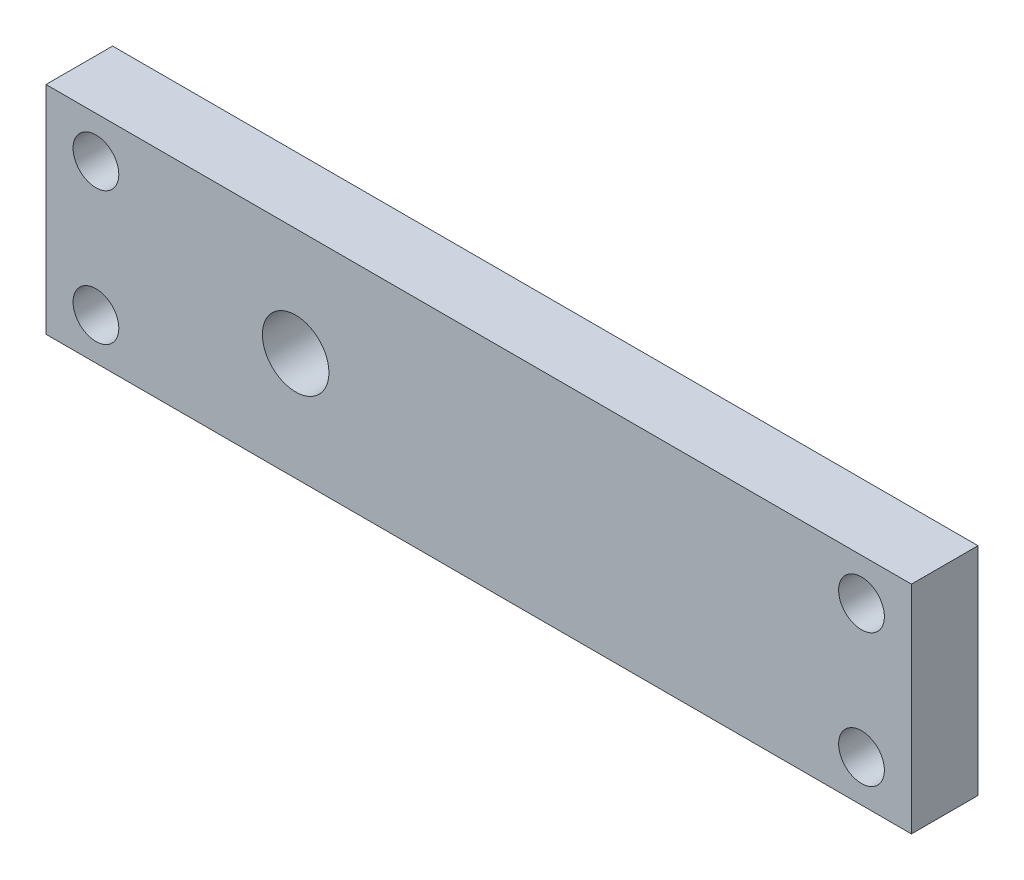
SolidWorks part; units mm, degrees
ref_plane "Face" through (0, 0, 0) normal (0, 0, 1) x (1, 0, 0)
ref_plane "Dessus" through (0, 0, 0) normal (0, 1, 0) x (1, 0, 0)
ref_plane "Droite" through (0, 0, 0) normal (1, 0, 0) x (0, 0, -1)
sketch "Esquisse1" plane through (0, 0, 0) normal (0, 0, 1) x (1, 0, 0)
  line L1 (0, 0) -> (104, 0)
  line L2 (0, 0) -> (0, 26)
  line L3 (0, 26) -> (104, 26)
  line L4 (104, 0) -> (104, 26)
  dimension "D1" = 104
  dimension "D2" = 26
extrude "Extrusion1" add sketch "Esquisse1" along normal blind 8
sketch "Esquisse2" plane through (0, 0, 8) normal (0, 0, 1) x (1, 0, 0)
  line L0 (104, 26) -> (0, 26) construction
  line L1 (0, 26) -> (0, 0) construction
  circle A0 centre (30, 13) radius 4
  dimension "D1" = 8
  dimension "D2" = 13
  dimension "D3" = 30
extrude "Enlèv. mat.-Extru.1" cut sketch "Esquisse2" against normal through all
hole_wizard "Dégagement M51" positions "Esquisse4" profile "Esquisse3" hole size "M5" standard "ISO"
sketch "Esquisse4" plane through (0, 0, 8) normal (0, 0, 1) x (1, 0, 0)
  line L0 (104, 26) -> (0, 26) construction
  line L1 (0, 0) -> (104, 0) construction
  line L2 (0, 26) -> (0, 0) construction
  line L3 (104, 0) -> (104, 26) construction
  point P0 (6, 21)
  point P1 (6, 5)
  point P3 (98, 21)
  point P5 (98, 5)
  dimension "D1" = 5
  dimension "D2" = 5
  dimension "D3" = 5
  dimension "D4" = 5
  dimension "D5" = 6
  dimension "D6" = 6
  dimension "D7" = 6
  dimension "D8" = 6
sketch "Esquisse3" plane through (6, 21, 8) normal (1, 0, 0) x (0, -1, 0)
  line L0 (0, 0) -> (0, 64.1524)
  line L1 (0, 64.1524) -> (2.75, 62.5)
  line L2 (2.75, 62.5) -> (2.75, 0)
  line L5 (2.75, 0) -> (0, 0)
  line L10 (0, 64.1524) -> (-2.75, 62.5) construction
  line L11 (0, -6.35) -> (0, 107.95) construction
  dimension "Diamètre du perçage" = 5.5
  dimension "Profondeur du perçage" = 62.5
  dimension "Angle de pointe" = 118
